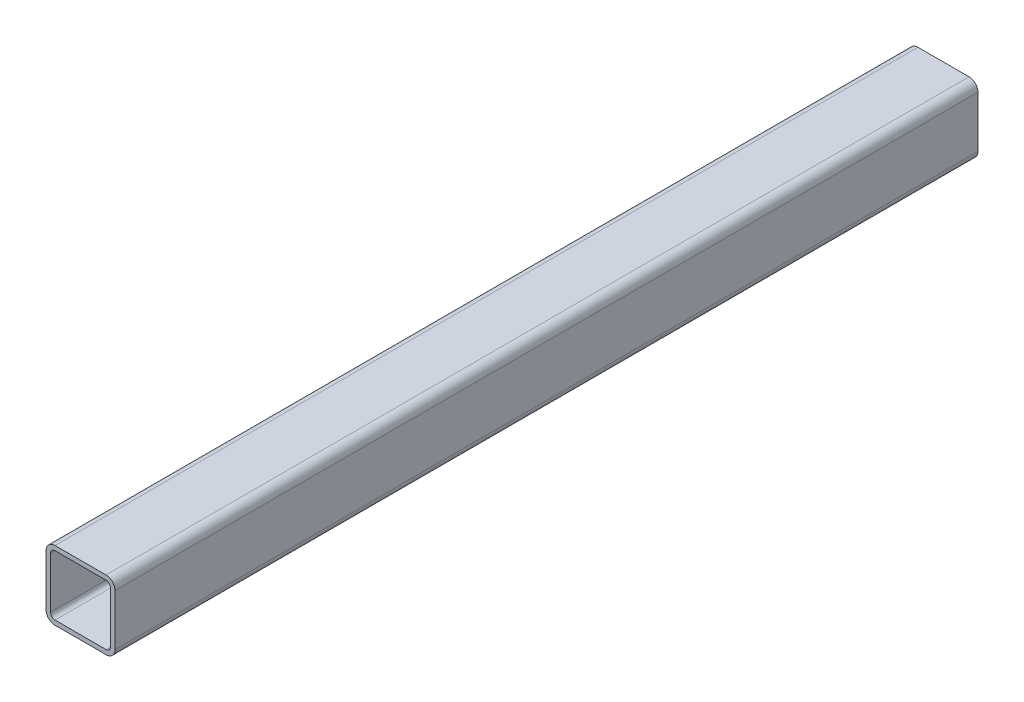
SolidWorks part; units mm, degrees
ref_plane "Alzado" through (0, 0, 0) normal (0, 0, 1) x (1, 0, 0)
ref_plane "Planta" through (0, 0, 0) normal (0, 1, 0) x (1, 0, 0)
ref_plane "Vista lateral" through (0, 0, 0) normal (1, 0, 0) x (0, 0, -1)
sketch "Croquis1" plane through (0, 0, 0) normal (0, 0, 1) x (1, 0, 0)
  line L0 (5.2, 3.75) -> (34.8, 3.75)
  line L1 (2.6, 6.35) -> (2.6, 35.95)
  line L2 (34.8, 38.55) -> (5.2, 38.55)
  line L3 (37.4, 35.95) -> (37.4, 6.35)
  line L4 (5.2, 1.15) -> (34.8, 1.15)
  line L5 (0, 6.35) -> (0, 35.95)
  line L6 (34.8, 41.15) -> (5.2, 41.15)
  line L7 (40, 35.95) -> (40, 6.35)
  arc A0 (40, 35.95) -> (34.8, 41.15) centre (34.8, 35.95) ccw
  arc A1 (34.8, 1.15) -> (40, 6.35) centre (34.8, 6.35) ccw
  arc A2 (0, 6.35) -> (5.2, 1.15) centre (5.2, 6.35) ccw
  arc A3 (5.2, 41.15) -> (0, 35.95) centre (5.2, 35.95) ccw
  arc A4 (5.2, 38.55) -> (2.6, 35.95) centre (5.2, 35.95) ccw
  arc A5 (37.4, 35.95) -> (34.8, 38.55) centre (34.8, 35.95) ccw
  arc A6 (34.8, 3.75) -> (37.4, 6.35) centre (34.8, 6.35) ccw
  arc A7 (2.6, 6.35) -> (5.2, 3.75) centre (5.2, 6.35) ccw
extrude "Extruir1" add sketch "Croquis1" along normal blind 500
